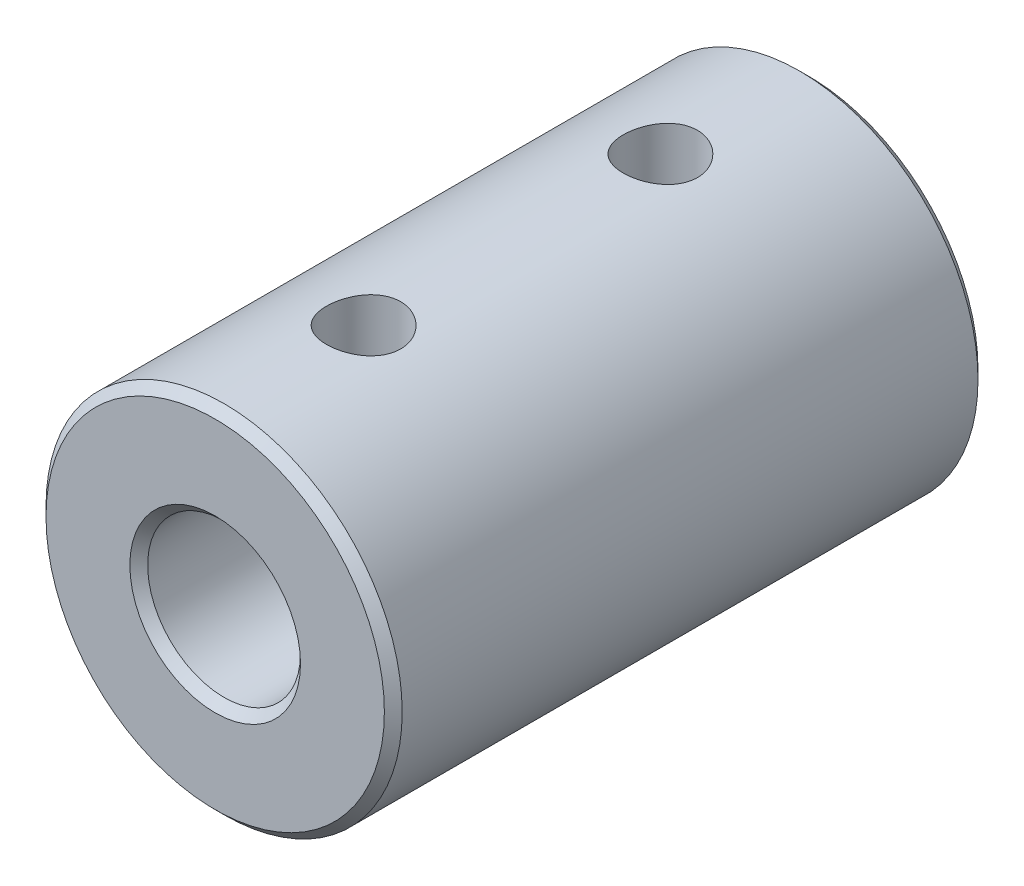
SolidWorks part; units mm, degrees
ref_plane "Plan de face" through (0, 0, 0) normal (0, 0, 1) x (1, 0, 0)
ref_plane "Plan de dessus" through (0, 0, 0) normal (0, 1, 0) x (1, 0, 0)
ref_plane "Plan de droite" through (0, 0, 0) normal (1, 0, 0) x (0, 0, -1)
sketch "Esquisse1" plane through (0, 0, 0) normal (0, 0, 1) x (1, 0, 0)
  circle A0 centre (0, 0) radius 6
  circle A1 centre (0, 0) radius 2.575
extrude "Boss.-Extru.1" add sketch "Esquisse1" along normal mid plane 20
ref_plane "Plan1" through (0, 0, 0) normal (0, 1, 0) x (-1, 0, 0)
sketch "Esquisse3" plane through (0, 0, 0) normal (0, 1, 0) x (-1, 0, 0)
  line L0 (0, -2.4446) -> (0, 9.3829) construction
  line L1 (-5.1223, 0) -> (1.4849, 0) construction
  line L2 (-5.1223, 5) -> (1.4849, 5) construction
  circle A0 centre (0, 5) radius 1.25
  circle A1 centre (0, -5) radius 1.25
  dimension "D1" = 5
extrude "Enlèv. mat.-Extru.2" cut sketch "Esquisse3" against normal mid plane 12
chamfer "Chanfrein1" distance 0.3 angle 45 4 edges at (2.575, 0, -10) (6, 0, -10) (6, 0, 10) (2.575, 0, 10)
